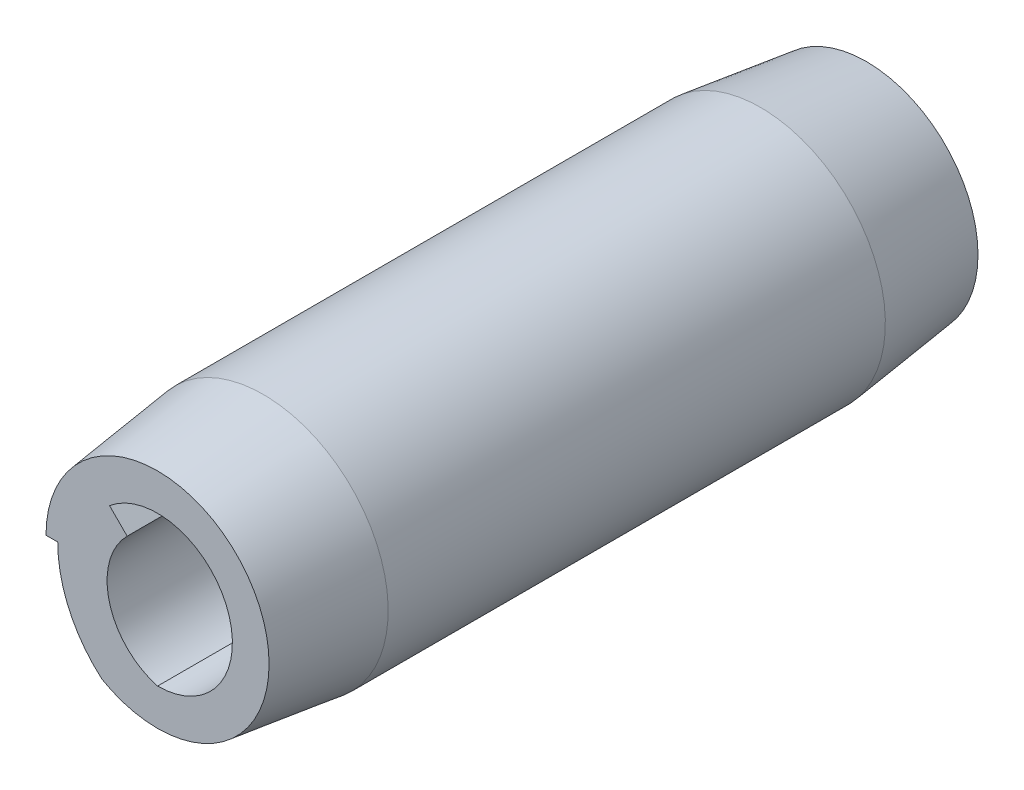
SolidWorks part; units mm, degrees
ref_plane "Plane1" through (0, 0, 0) normal (0, 0, 1) x (1, 0, 0)
ref_plane "Plane2" through (0, 0, 0) normal (0, 1, 0) x (1, 0, 0)
ref_plane "Plane3" through (0, 0, 0) normal (1, 0, 0) x (0, 0, -1)
sketch "Sketch1" plane through (0, 0, 0) normal (0, 0, 1) x (1, 0, 0)
  line L0 (0.922, 0) -> (-0.922, 0) construction
  line L1 (0, -0.9335) -> (0, 0.9335) construction
  line L2 (-0.8382, 0) -> (-0.6706, 0)
  line L3 (-0.6706, 0) -> (-0.5029, 0) construction
  line L4 (-0.3226, 0.3858) -> (-0.2041, 0.2673)
  line L5 (-0.5029, 0) -> (-0.3353, 0) construction
  arc A0 (-0.8382, 0) -> (0, -0.8382) centre (0, 0) cw
  arc A1 (-0.6706, 0) -> (0, -0.6706) centre (0, 0) cw construction
  arc A2 (0, -0.8382) -> (-0.6706, 0) centre (0.1886, 0) cw
  arc A3 (-0.5029, 0) -> (-0.3226, 0.3858) centre (0, 0) cw construction
  arc A4 (0, -0.5029) -> (-0.2041, 0.2673) centre (0.1218, -0.0585) cw
  arc A5 (-0.3226, 0.3858) -> (0, -0.5029) centre (0, 0) cw
  circle A6 centre (0, 0) radius 0.7493 construction
extrude "Boss-Extrude1" add sketch "Sketch1" along normal mid plane 4.7625
sketch "ChamferSke" plane through (0, 0, 0) normal (1, 0, 0) x (0, 0, -1)
  line L0 (-2.3813, 1.466) -> (-2.3813, 0.7493)
  line L1 (-2.3813, 0.7493) -> (-1.6701, 0.8382)
  line L2 (-1.6701, 0.8382) -> (1.6701, 0.8382)
  line L3 (1.6701, 0.8382) -> (2.3813, 0.7493)
  line L4 (2.3813, 0.7493) -> (2.3813, 1.466)
  line L5 (2.3813, 1.466) -> (-2.3813, 1.466)
  line L7 (0, 0) -> (-2.3813, 0) construction
revolve "Chamfer" cut sketch "ChamferSke" angle 360 about L7
equation "\"D1@Sketch1\"=\"Diameter@Sketch1\"/10"
equation "\"D1@ChamferSke\" = \"ChamferB@Sketch1\""
equation "\"D2@ChamferSke\" = \"Diameter@Sketch1\""
